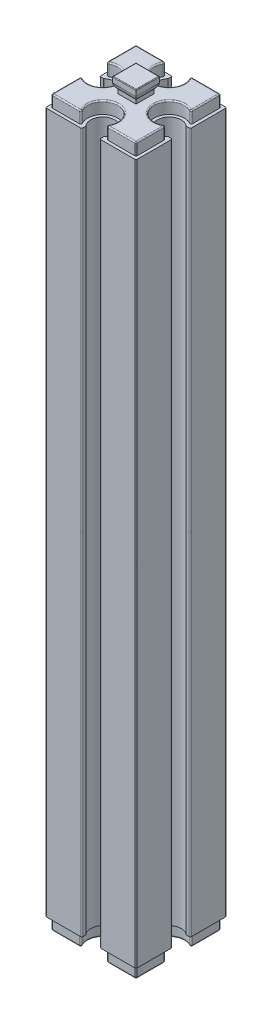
SolidWorks part; units mm, degrees
ref_plane "前视基准面" through (0, 0, 0) normal (0, 0, 1) x (1, 0, 0)
ref_plane "上视基准面" through (0, 0, 0) normal (0, 1, 0) x (1, 0, 0)
ref_plane "右视基准面" through (0, 0, 0) normal (1, 0, 0) x (0, 0, -1)
sketch "草图1" plane through (0, 0, 0) normal (0, 1, 0) x (1, 0, 0)
  line L0 (0, 0) -> (0, 7.5) construction
  line L1 (0, 0) -> (7.5, 0) construction
  line L2 (-7.5, 7.5) -> (-1.5, 7.5)
  line L3 (7.5, 7.5) -> (7.5, 1.5)
  line L4 (6.8229, 1.5) -> (7.5, 1.5)
  line L5 (6.8229, -1.5) -> (7.5, -1.5)
  line L6 (0, 7.5) -> (0, 5.5) construction
  line L7 (-1.5, 6.8229) -> (-1.5, 7.5)
  line L8 (1.5, 6.8229) -> (1.5, 7.5)
  line L9 (1.5, 7.5) -> (7.5, 7.5)
  line L10 (7.5, -1.5) -> (7.5, -7.5)
  line L11 (7.5, -7.5) -> (1.5, -7.5)
  line L12 (1.5, -6.8229) -> (1.5, -7.5)
  line L13 (-1.5, -6.8229) -> (-1.5, -7.5)
  line L14 (-1.5, -7.5) -> (-7.5, -7.5)
  line L15 (-7.5, -7.5) -> (-7.5, -1.5)
  line L16 (-6.8229, -1.5) -> (-7.5, -1.5)
  line L17 (-6.8229, 1.5) -> (-7.5, 1.5)
  line L18 (-7.5, 1.5) -> (-7.5, 7.5)
  arc A0 (-1.5, 6.8229) -> (1.5, 6.8229) centre (0, 5.5) ccw
  arc A1 (6.8229, 1.5) -> (6.8229, -1.5) centre (5.5, 0) ccw
  arc A2 (1.5, -6.8229) -> (-1.5, -6.8229) centre (0, -5.5) ccw
  arc A3 (-6.8229, -1.5) -> (-6.8229, 1.5) centre (-5.5, 0) ccw
  point P36 (0, 0)
  dimension "D6" = 4
  dimension "D7" = 2
  dimension "D1" = 7.5
  dimension "D2" = 7.5
  dimension "D3" = 2
  dimension "D4" = 7.5
  dimension "D5" = 1.5
extrude "凸台-拉伸1" add sketch "草图1" along normal blind 58
sketch "草图2" plane through (0, 58, 0) normal (0, 1, 0) x (1, 0, 0)
  line L0 (-7, 7) -> (-7, 2)
  line L1 (-7, 2) -> (-7, 2)
  line L2 (-7, -2) -> (-7, -2)
  line L3 (-7, -2) -> (-7, -7)
  line L4 (-7, -7) -> (-2, -7)
  line L5 (-2, -7) -> (-2, -7)
  line L6 (2, -7) -> (2, -7)
  line L7 (2, -7) -> (7, -7)
  line L8 (7, -7) -> (7, -2)
  line L9 (7, -2) -> (7, -2)
  line L10 (7, 2) -> (7, 2)
  line L11 (7, 2) -> (7, 7)
  line L12 (7, 7) -> (2, 7)
  line L13 (2, 7) -> (2, 7)
  line L14 (-2, 7) -> (-2, 7)
  line L15 (-2, 7) -> (-7, 7)
  line L16 (-7.5, 7.5) -> (-7.5, 1.5)
  line L17 (-7.5, 1.5) -> (-6.8229, 1.5)
  line L18 (-6.8229, -1.5) -> (-7.5, -1.5)
  line L19 (-7.5, -1.5) -> (-7.5, -7.5)
  line L20 (-7.5, -7.5) -> (-1.5, -7.5)
  line L21 (-1.5, -7.5) -> (-1.5, -6.8229)
  line L22 (1.5, -6.8229) -> (1.5, -7.5)
  line L23 (1.5, -7.5) -> (7.5, -7.5)
  line L24 (7.5, -7.5) -> (7.5, -1.5)
  line L25 (7.5, -1.5) -> (6.8229, -1.5)
  line L26 (6.8229, 1.5) -> (7.5, 1.5)
  line L27 (7.5, 1.5) -> (7.5, 7.5)
  line L28 (7.5, 7.5) -> (1.5, 7.5)
  line L29 (1.5, 7.5) -> (1.5, 6.8229)
  line L30 (-1.5, 6.8229) -> (-1.5, 7.5)
  line L31 (-1.5, 7.5) -> (-7.5, 7.5)
  line L32 (-7.5, 7.5) -> (-7.5, 1.5) construction
  line L33 (-7.5, 1.5) -> (-6.8229, 1.5) construction
  line L34 (-6.8229, -1.5) -> (-7.5, -1.5) construction
  line L35 (-7.5, -1.5) -> (-7.5, -7.5) construction
  line L36 (-7.5, -7.5) -> (-1.5, -7.5) construction
  line L37 (-1.5, -7.5) -> (-1.5, -6.8229) construction
  line L38 (1.5, -6.8229) -> (1.5, -7.5) construction
  line L39 (1.5, -7.5) -> (7.5, -7.5) construction
  line L40 (7.5, -7.5) -> (7.5, -1.5) construction
  line L41 (7.5, -1.5) -> (6.8229, -1.5) construction
  line L42 (6.8229, 1.5) -> (7.5, 1.5) construction
  line L43 (7.5, 1.5) -> (7.5, 7.5) construction
  line L44 (7.5, 7.5) -> (1.5, 7.5) construction
  line L45 (1.5, 7.5) -> (1.5, 6.8229) construction
  line L46 (-1.5, 6.8229) -> (-1.5, 7.5) construction
  line L47 (-1.5, 7.5) -> (-7.5, 7.5) construction
  arc A0 (-7, -2) -> (-7, 2) centre (-5.5, 0) ccw
  arc A1 (2, -7) -> (-2, -7) centre (0, -5.5) ccw
  arc A2 (7, 2) -> (7, -2) centre (5.5, 0) ccw
  arc A3 (-2, 7) -> (2, 7) centre (0, 5.5) ccw
  arc A4 (-6.8229, -1.5) -> (-6.8229, 1.5) centre (-5.5, 0) ccw
  arc A5 (1.5, -6.8229) -> (-1.5, -6.8229) centre (0, -5.5) ccw
  arc A6 (6.8229, 1.5) -> (6.8229, -1.5) centre (5.5, 0) ccw
  arc A7 (-1.5, 6.8229) -> (1.5, 6.8229) centre (0, 5.5) ccw
  arc A8 (-6.8229, -1.5) -> (-6.8229, 1.5) centre (-5.5, 0) ccw construction
  arc A9 (1.5, -6.8229) -> (-1.5, -6.8229) centre (0, -5.5) ccw construction
  arc A10 (6.8229, 1.5) -> (6.8229, -1.5) centre (5.5, 0) ccw construction
  arc A11 (-1.5, 6.8229) -> (1.5, 6.8229) centre (0, 5.5) ccw construction
  dimension "D1" = 0
  dimension "D2" = 0.5
extrude "凸台-拉伸2" add sketch "草图2" along normal blind 2
sketch "草图3" plane through (0, 0, 0) normal (1, 0, 0) x (0, 0, -1)
  line L0 (0, 60) -> (0, 62) construction
  line L1 (2.5, 60) -> (-2.5, 60) construction
  line L2 (0, 62) -> (0, 62.5) construction
  line L3 (-1.5, 60) -> (1.5, 60)
  line L4 (1.5, 60) -> (1.5, 60.6771)
  line L5 (-1.95, 62.5) -> (1.95, 62.5)
  line L6 (1.95, 62.5) -> (1.95, 61.5556)
  line L7 (-1.5, 60) -> (-1.5, 60.6771)
  line L8 (-1.95, 62.5) -> (-1.95, 61.5556)
  arc A0 (-1.5, 60.6771) -> (-1.95, 61.5556) centre (0, 62) cw
  arc A1 (1.5, 60.6771) -> (1.95, 61.5556) centre (0, 62) ccw
  dimension "D5" = 2
  dimension "D1" = 2
  dimension "D2" = 0.5
  dimension "D3" = 1.5
  dimension "D4" = 1.95
extrude "凸台-拉伸3" add sketch "草图3" along normal blind 2 and the other way blind 2
sketch "草图4" plane through (0, 0, 0) normal (0, 0, 1) x (1, 0, 0)
  line L0 (0, 60) -> (0, 62) construction
  line L2 (-2, 60) -> (2, 60) construction
  line L3 (0, 62) -> (0, 62.5) construction
  line L4 (-2, 62.5) -> (2, 62.5) construction
  line L5 (1.95, 62.5) -> (2, 62.5)
  line L6 (-1.95, 62.5) -> (-1.95, 61.5556)
  line L9 (-1.5, 60) -> (-1.5, 60.6771)
  line L10 (1.5, 60) -> (1.5, 60.6771)
  line L11 (1.95, 62.5) -> (1.95, 61.5556)
  line L12 (1.5, 60) -> (2, 60)
  line L13 (-2, 62.5) -> (-1.95, 62.5)
  line L14 (-2, 62.5) -> (-2, 60)
  line L15 (-2, 60) -> (-1.5, 60)
  line L16 (2, 62.5) -> (2, 60)
  arc A0 (-1.95, 61.5556) -> (-1.5, 60.6771) centre (0, 62) ccw
  arc A1 (1.95, 61.5556) -> (1.5, 60.6771) centre (0, 62) cw
  dimension "D1" = 2
  dimension "D2" = 1.5
  dimension "D3" = 1.95
fillet "圆角3" radius 0.2 13 edges at (-1.5, 29, -7.5) (1.5, 29, -7.5) (7.5, 29, -7.5) (7.5, 29, -1.5) (7.5, 29, 1.5) (7.5, 29, 7.5) (-1.5, 29, 7.5) (1.5, 29, 7.5) (-6.8229, 29, -1.5) (-7.5, 29, 7.5) (-7.5, 29, 1.5) (-7.5, 29, -1.5) (-7.5, 29, -7.5)
extrude "切除-拉伸1" cut sketch "草图4" against normal blind 3 and the other way blind 3
fillet "圆角4" radius 0.2 24 edges at (0, 60, 3) (-3, 60, 0) (0, 60, -3) (3, 60, 0) (7, 59, 2) (7, 59, -2) (2, 59, -7) (-2, 59, -7) (-7, 59, 2) (-7, 59, -2) (2, 59, 7) (-2, 59, 7) (7, 59, 7) (4.5, 60, 7) (7, 60, 4.5) (7, 60, -4.5) (7, 59, -7) (4.5, 60, -7) (-4.5, 60, -7) (-7, 59, -7) (-7, 60, -4.5) (-4.5, 60, 7) (-7, 60, 4.5) (-7, 59, 7)
fillet "圆角5" radius 0.1 4 edges at (0, 62.5, -1.95) (1.95, 62.5, 0) (0, 62.5, 1.95) (-1.95, 62.5, 0)
mirror "镜向1" of "圆角5", "圆角4", "切除-拉伸1", "圆角3", "凸台-拉伸3", "凸台-拉伸2", "凸台-拉伸1"
